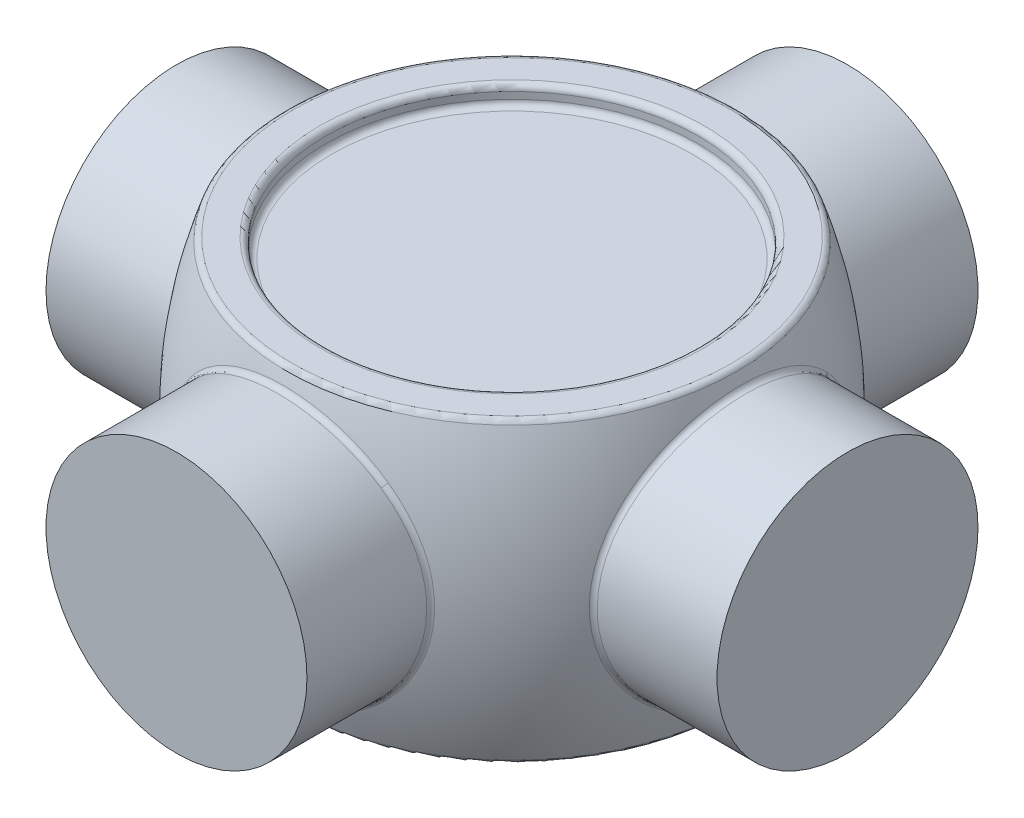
SolidWorks part; units mm, degrees
ref_plane "Plan de face" through (0, 0, 0) normal (0, 0, 1) x (1, 0, 0)
ref_plane "Plan de dessus" through (0, 0, 0) normal (0, 1, 0) x (1, 0, 0)
ref_plane "Plan de droite" through (0, 0, 0) normal (1, 0, 0) x (0, 0, -1)
imported_body "Importée1"
scale "Echelle1" scale about centroid uniform scaling yes scale factor 0.5
